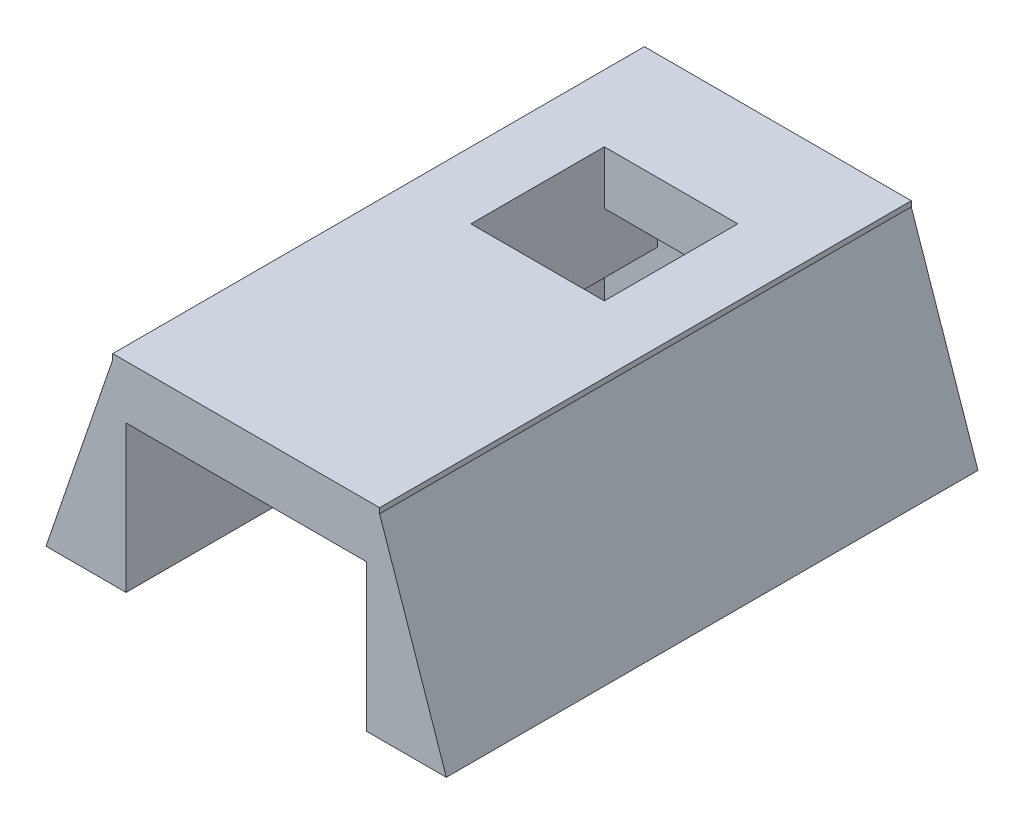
SolidWorks part; units mm, degrees
ref_plane "Front Plane" through (0, 0, 0) normal (0, 0, 1) x (1, 0, 0)
ref_plane "Top Plane" through (0, 0, 0) normal (0, 1, 0) x (1, 0, 0)
ref_plane "Right Plane" through (0, 0, 0) normal (1, 0, 0) x (0, 0, -1)
sketch "Sketch2" plane through (0, 0, 0) normal (0, 0, 1) x (1, 0, 0)
  line L0 (-7.5, 0) -> (-5, 7.3)
  line L1 (-5, 7.3) -> (-5, 7.5)
  line L2 (-5, 7.5) -> (5, 7.5)
  line L3 (0, 1.6079) -> (0, -0.5641) construction
  line L4 (-7.5, 0) -> (7.5, 0)
  line L5 (5, 7.3) -> (5, 7.5)
  line L6 (7.5, 0) -> (5, 7.3)
  point P9 (0, 0)
  point P10 (0, 7.5)
  dimension "D1" = 0.2
  dimension "D2" = 2.5
  dimension "D3" = 7.5
  dimension "D4" = 5
extrude "Boss-Extrude1" add sketch "Sketch2" along normal blind 19.9205
sketch "Sketch3" plane through (0, 0, 0) normal (0, 1, 0) x (1, 0, 0)
  line L0 (0, -19.9205) -> (0, -13.5866) construction
  line L1 (5, -19.9205) -> (-5, -19.9205) construction
  line L2 (-4.5, -19.9205) -> (4.5, -19.9205)
  line L3 (-2.5, 0) -> (2.5, 0)
  line L4 (-7.5, 0) -> (7.5, 0) construction
  line L5 (-2.5, -11) -> (-2.5, 0)
  line L7 (-2.5, -11) -> (-4.5, -11)
  line L8 (-4.5, -11) -> (-4.5, -19.9205)
  line L9 (-7.5, -19.9205) -> (7.5, -19.9205) construction
  line L10 (4.5, -11) -> (4.5, -19.9205)
  line L11 (2.5, -11) -> (4.5, -11)
  line L12 (2.5, -11) -> (2.5, 0)
  point P6 (0, -19.9205)
  point P10 (0, -19.9205)
  point P11 (0, 0)
  point P21 (0, 0)
  dimension "D1" = 2.5
  dimension "D2" = 9
  dimension "D3" = 11
extrude "Cut-Extrude3" cut sketch "Sketch3" along normal blind 5.5
sketch "Sketch5" plane through (0, 0, 0) normal (0, 0, -1) x (-1, 0, 0)
  line L0 (-4.5, 0) -> (-4.5, 3.25)
  line L1 (-2.5, 0) -> (-7.5, 0) construction
  line L2 (-4.5, 3.25) -> (4.5, 3.25)
  line L3 (4.5, 3.25) -> (4.5, 0)
  line L4 (4.5, 0) -> (-4.5, 0)
  line L5 (-2.5, 5.5) -> (2.5, 5.5) construction
  point P10 (0, 5.5)
  point P11 (0, 3.25)
  dimension "D1" = 9
  dimension "D2" = 2.25
extrude "Cut-Extrude5" cut sketch "Sketch5" against normal through all
sketch "Sketch6" plane through (0, 3.25, 0) normal (0, -1, 0) x (1, 0, 0)
  line L0 (6, 0) -> (-6, 0)
  line L1 (4.5, 0) -> (7.5, 0) construction
  line L2 (-7.5, 0) -> (-4.5, 0) construction
  line L3 (-6, 0) -> (-6, 2)
  line L4 (-6, 2) -> (6, 2)
  line L5 (6, 2) -> (6, 0)
  dimension "D1" = 2
extrude "Boss-Extrude2" add sketch "Sketch6" along normal up to surface (3.25 mm away)
sketch "Sketch7" plane through (0, 0, 0) normal (0, -1, 0) x (1, 0, 0)
  line L0 (3.5589, 0) -> (3.5589, 2)
  line L1 (-7.5, 0) -> (7.5, 0) construction
  line L2 (-4.5, 2) -> (4.5, 2) construction
  line L3 (3.5589, 2) -> (-3.5, 2)
  line L4 (-2.5, 2) -> (-4.5, 2) construction
  line L5 (-3.5, 2) -> (-3.5, 0)
  line L6 (-3.5, 0) -> (3.5589, 0)
extrude "Boss-Extrude3" add sketch "Sketch7" against normal blind 6
sketch "Sketch4" plane through (0, 7.5, 0) normal (0, 1, 0) x (1, 0, 0)
  line L0 (0, 0) -> (0, -11.2083) construction
  line L2 (2.5, -9) -> (-2.5, -9)
  line L3 (2.5, -9) -> (2.5, -4)
  line L4 (2.5, -4) -> (-2.5, -4)
  line L5 (-2.5, -9) -> (-2.5, -4)
  line L6 (2.5, -9) -> (-2.5, -4) construction
  line L7 (2.5, -4) -> (-2.5, -9) construction
  line L9 (2.5, -11) -> (2.5, -2) construction
  point P3 (0, -6.5)
  point P10 (2.5, -6.5)
  point P13 (2.5, -6.5)
  dimension "D1" = 5
  dimension "D2" = 5
extrude "Cut-Extrude4" cut sketch "Sketch4" against normal through all
